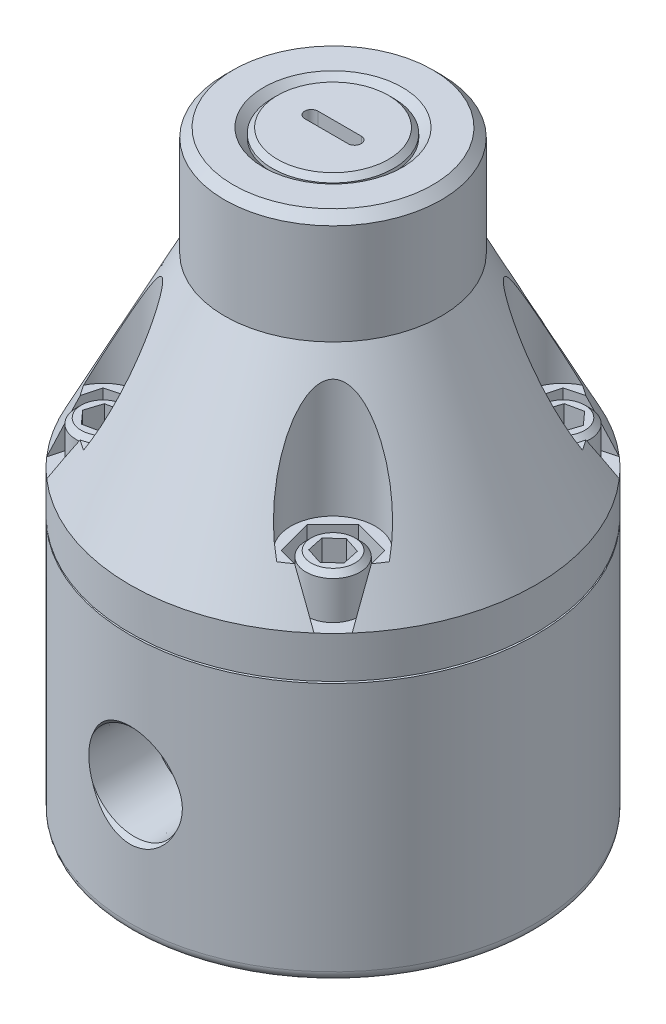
SolidWorks part; units mm, degrees
ref_plane "Front Plane" through (0, 0, 0) normal (0, 0, 1) x (1, 0, 0)
ref_plane "Top Plane" through (0, 0, 0) normal (0, 1, 0) x (1, 0, 0)
ref_plane "Right Plane" through (0, 0, 0) normal (1, 0, 0) x (0, 0, -1)
sketch "Sketch1" plane through (0, 0, 0) normal (0, 1, 0) x (1, 0, 0)
  circle A0 centre (0, 0) radius 29.718
  dimension "D1" = 59.436
extrude "Extrude1" add sketch "Sketch1" along normal blind 87.63
sketch "Sketch2" plane through (0, 0, 0) normal (0, 0, 1) x (1, 0, 0)
  line L0 (0, 0) -> (0, 87.63) construction
  line L1 (29.718, 87.63) -> (-29.718, 87.63) construction
  line L2 (-34.5439, 38.1) -> (-19.05, 38.1)
  line L3 (-19.05, 38.1) -> (-19.05, 38.354)
  line L4 (-19.05, 38.354) -> (-29.718, 38.354)
  line L5 (-15.875, 71.628) -> (-15.875, 89.2885)
  line L6 (-15.875, 89.2885) -> (-34.5439, 89.2885)
  line L7 (-34.5439, 89.2885) -> (-34.5439, 38.1)
  line L8 (-29.718, 87.63) -> (-29.718, 0) construction
  line L9 (-29.718, 38.354) -> (-29.718, 44.45)
  line L10 (-29.718, 0) -> (29.718, 0) construction
  line L11 (-29.718, 44.45) -> (-15.875, 71.628)
  dimension "D1" = 38.1
  dimension "D2" = 0.254
  dimension "D3" = 6.35
  dimension "D4" = 27.178
  dimension "D5" = 15.875
  dimension "D6" = 19.05
revolve "Cut-Revolve1" cut sketch "Sketch2" angle 360 about L0
ref_plane "Plane1" through (0, 87.63, 0) normal (0, 1, 0) x (-1, 0, 0)
sketch "Sketch3" plane through (0, 87.63, 0) normal (0, 1, 0) x (-1, 0, 0)
  circle A0 centre (0, 0) radius 10.16
  dimension "D1" = 20.32
extrude "Extrude2" cut sketch "Sketch3" against normal blind 1.27 draft 45
ref_plane "Plane2" through (0, 0, 29.718) normal (0, 0, 1) x (1, 0, 0)
sketch "Sketch4" plane through (0, 0, 29.718) normal (0, 0, 1) x (1, 0, 0)
  line L0 (0, 0) -> (0, 19.05) construction
  dimension "D1" = 19.05
hole_wizard "1/4 NPT Tapped Hole5" positions "3DSketch3" profile "Sketch6" size "1/4" standard "Ansi Inch"
sketch3d "3DSketch3"
  point P0 (0, 19.05, 29.718)
  point P4 (0, 19.05, 29.718)
sketch "Sketch6" plane through (0, 19.05, 29.718) normal (1, 0, 0) x (0, -1, 0)
  line L0 (0, 0) -> (0, 15.0041)
  line L1 (5.5626, 12.7) -> (0, 15.0041)
  line L2 (-5.5626, 12.7) -> (0, 15.0041) construction
  line L3 (5.5626, 12.7) -> (5.5626, 9.906)
  line L4 (5.5626, 9.906) -> (6.577, 9.906)
  line L5 (6.577, 9.906) -> (6.8546, 0.635)
  line L6 (6.8546, 0.635) -> (7.4896, 0)
  line L7 (7.4896, 0) -> (0, 0)
  line L8 (0, -6.35) -> (0, 107.95) construction
  line L9 (-6.8546, 0.635) -> (-7.4896, 0) construction
  line L11 (-5.5626, 9.906) -> (-6.577, 9.906) construction
  line L12 (-6.577, 9.906) -> (-6.8546, 0.635) construction
  dimension "Tap Drill Dia." = 11.1252
  dimension "Tap Drill Depth" = 12.7
  dimension "Thread Dia." = 13.7092
  dimension "Thread Angle" = 3.43
  dimension "Thread Depth" = 9.906
  dimension "C'Sink Dia." = 14.9792
  dimension "C'Sink Angle" = 90
  dimension "Drill Angle" = 135
pattern_circular "CirPattern1" count 2 over 360 about axis through (0, 87.63, 0) along (0, -1, 0) of "1/4 NPT Tapped Hole5"
chamfer "Chamfer1" distance 1.27 angle 45 1 edges at (0, 87.63, 15.875)
fillet "Fillet1" radius 1.524 1 edges at (0, 0, 29.718)
sketch "Sketch7" plane through (0, 87.63, 0) normal (0, 1, 0) x (-1, 0, 0)
  circle A0 centre (0, 0) radius 8.89
extrude "Extrude4" add sketch "Sketch7" against normal up to surface (1.27 mm away)
sketch "Sketch10" plane through (0, 87.63, 0) normal (0, 1, 0) x (-1, 0, 0)
  line L0 (-3.175, 0) -> (3.175, 0) construction
  line L1 (-3.175, 0.9652) -> (3.175, 0.9652)
  line L2 (-3.175, -0.9652) -> (3.175, -0.9652)
  arc A0 (-3.175, 0.9652) -> (-3.175, -0.9652) centre (-3.175, 0) ccw
  arc A1 (3.175, 0.9652) -> (3.175, -0.9652) centre (3.175, 0) cw
  dimension "D1" = 3.175
  dimension "D2" = 6.35
  dimension "D3" = 0.9652
  dimension "D4" = 0.9652
  dimension "D5" = 3.175
  dimension "D6" = 6.35
extrude "Extrude5" cut sketch "Sketch10" against normal blind 4.7498
chamfer "Chamfer4" distance 0.762 angle 45 1 edges at (0, 87.63, 8.89)
ref_plane "Plane3" through (0, 50.8, 0) normal (0, 1, 0) x (-1, 0, 0)
sketch "Sketch11" plane through (0, 50.8, 0) normal (0, 1, 0) x (-1, 0, 0)
  line L0 (0, 0) -> (0, -29.718) construction
  line L1 (0, 0) -> (-21.0138, -21.0138) construction
  circle A0 centre (0, 0) radius 23.8125 construction
  circle A1 centre (0, 0) radius 29.718 construction
  circle A2 centre (-16.838, -16.838) radius 6.1722
  dimension "D1" = 47.625
  dimension "D3" = 12.3444
  dimension "D2" = 45
extrude "Extrude6" cut sketch "Sketch11" along normal blind 21.2598
pattern_circular "CirPattern2" count 4 over 360 about axis through (0, 0, 0) along (0, 1, 0) of "Extrude6"
sketch "Sketch12" plane through (0, 50.8, 0) normal (0, 1, 0) x (-1, 0, 0)
  line L0 (0, 0) -> (0, -29.718) construction
  line L1 (0, 0) -> (-21.0138, -21.0138) construction
  line L2 (-16.838, -16.838) -> (-13.5512, -20.1248) construction
  line L3 (-20.6256, -13.0646) -> (-23.3737, -23.3983)
  line L4 (-13.0504, -20.6114) -> (-11.6763, -15.4445)
  line L5 (-11.6763, -15.4445) -> (-15.4639, -11.6711)
  line L6 (-15.4639, -11.6711) -> (-20.6256, -13.0646)
  line L10 (-23.3737, -23.3983) -> (-13.0504, -20.6114)
  line L13 (-21.9996, -18.2314) -> (-18.2121, -22.0048)
  line L14 (-20.6256, -13.0646) -> (-21.9996, -18.2314)
  line L15 (-18.2121, -22.0048) -> (-13.0504, -20.6114)
  circle A0 centre (0, 0) radius 23.8125 construction
  circle A1 centre (0, 0) radius 29.718 construction
  circle A2 centre (-16.838, -16.838) radius 4.6482 construction
  circle A3 centre (-16.838, -16.838) radius 4.6301 construction
  dimension "D1" = 47.625
  dimension "D3" = 9.2964
  dimension "D2" = 45
  dimension "D4" = 4.6482
extrude "Extrude7" cut sketch "Sketch12" against normal blind 6.35
pattern_circular "CirPattern3" count 4 over 360 about axis through (0, 0, 0) along (0, 1, 0) of "Extrude7"
sketch "Sketch13" plane through (0, 50.8, 0) normal (0, 1, 0) x (-1, 0, 0)
  line L0 (0, 0) -> (-21.0073, -21.0203) construction
  arc A0 (-22.3577, -19.5779) -> (-19.564, -22.3698) centre (0, 0) ccw construction
  circle A1 centre (0, 0) radius 23.8125 construction
  circle A2 centre (-16.8328, -16.8432) radius 3.9624
  dimension "D1" = 7.9248
extrude "Extrude8" add sketch "Sketch13" against normal up to surface (6.35 mm away)
sketch "Sketch14" plane through (0, 50.8, 0) normal (0, 1, 0) x (-1, 0, 0)
  line L1 (-15.1431, -18.7188) -> (-14.3636, -16.3177)
  line L2 (-14.3636, -16.3177) -> (-16.0533, -14.4421)
  line L3 (-16.0533, -14.4421) -> (-18.5224, -14.9676)
  line L4 (-18.5224, -14.9676) -> (-19.3019, -17.3687)
  line L5 (-19.3019, -17.3687) -> (-17.6123, -19.2443)
  line L6 (-17.6123, -19.2443) -> (-15.1431, -18.7188)
  circle A0 centre (-16.8328, -16.8432) radius 2.1862 construction
extrude "Extrude9" cut sketch "Sketch14" against normal blind 3.175
chamfer "Chamfer5" distance 0.762 angle 45 1 edges at (16.8328, 50.8, -12.8808)
pattern_circular "CirPattern4" count 4 over 360 about axis through (0, 0, 0) along (0, 1, 0) of "Extrude8", "Extrude9", "Chamfer5"
